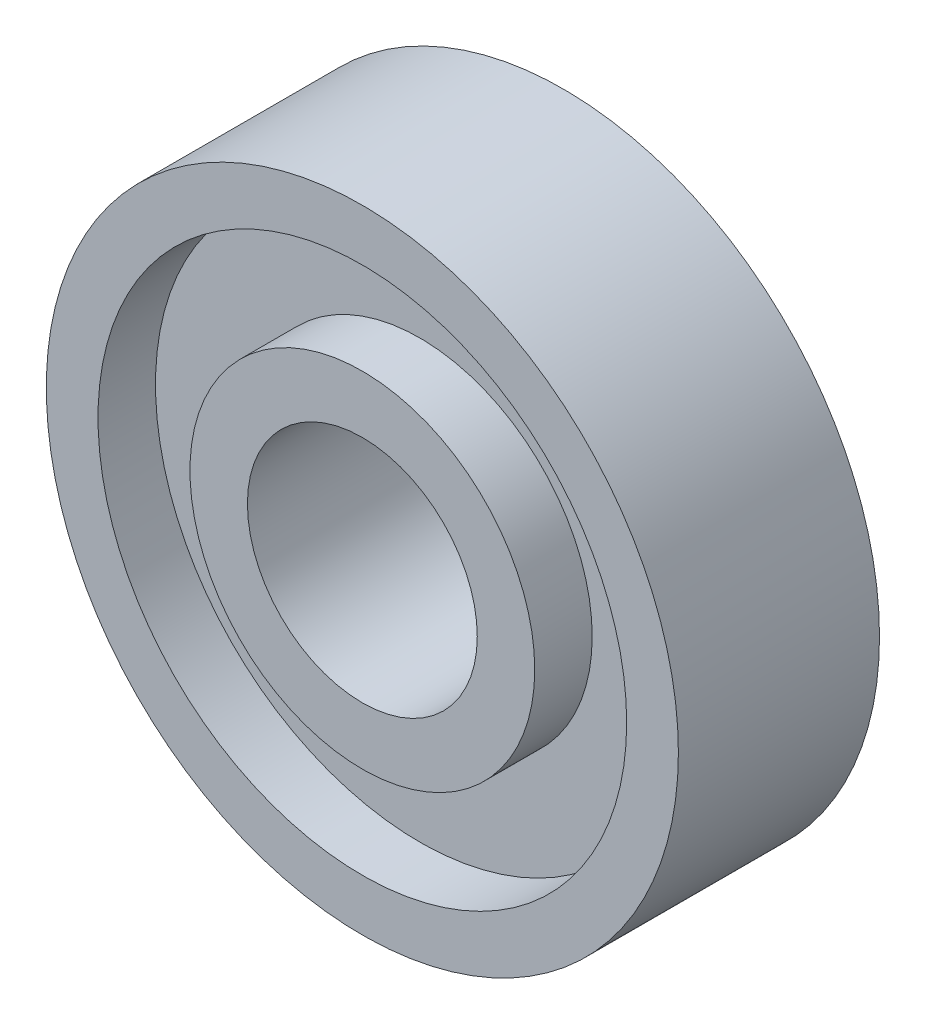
SolidWorks part; units mm, degrees
ref_plane "Front Plane" through (0, 0, 0) normal (0, 0, 1) x (1, 0, 0)
ref_plane "Top Plane" through (0, 0, 0) normal (0, 1, 0) x (1, 0, 0)
ref_plane "Right Plane" through (0, 0, 0) normal (1, 0, 0) x (0, 0, -1)
sketch "Sketch1" plane through (0, 0, 0) normal (0, 0, 1) x (1, 0, 0)
  circle A0 centre (0, 0) radius 11
  dimension "D1" = 22
extrude "Boss-Extrude1" add sketch "Sketch1" along normal mid plane 7
sketch "Sketch2" plane through (0, 0, 3.5) normal (0, 0, 1) x (1, 0, 0)
  circle A0 centre (0, 0) radius 6
  circle A1 centre (0, 0) radius 9.2
  dimension "D1" = 12
  dimension "D2" = 18.4
extrude "Cut-Extrude1" cut sketch "Sketch2" against normal blind 2
mirror "Mirror1" about plane through (0, 0, 0) normal (0, 0, 1) of "Cut-Extrude1"
sketch "Sketch3" plane through (0, 0, 3.5) normal (0, 0, 1) x (1, 0, 0)
  circle A0 centre (0, 0) radius 4
  dimension "D1" = 8
extrude "Cut-Extrude2" cut sketch "Sketch3" against normal through all
